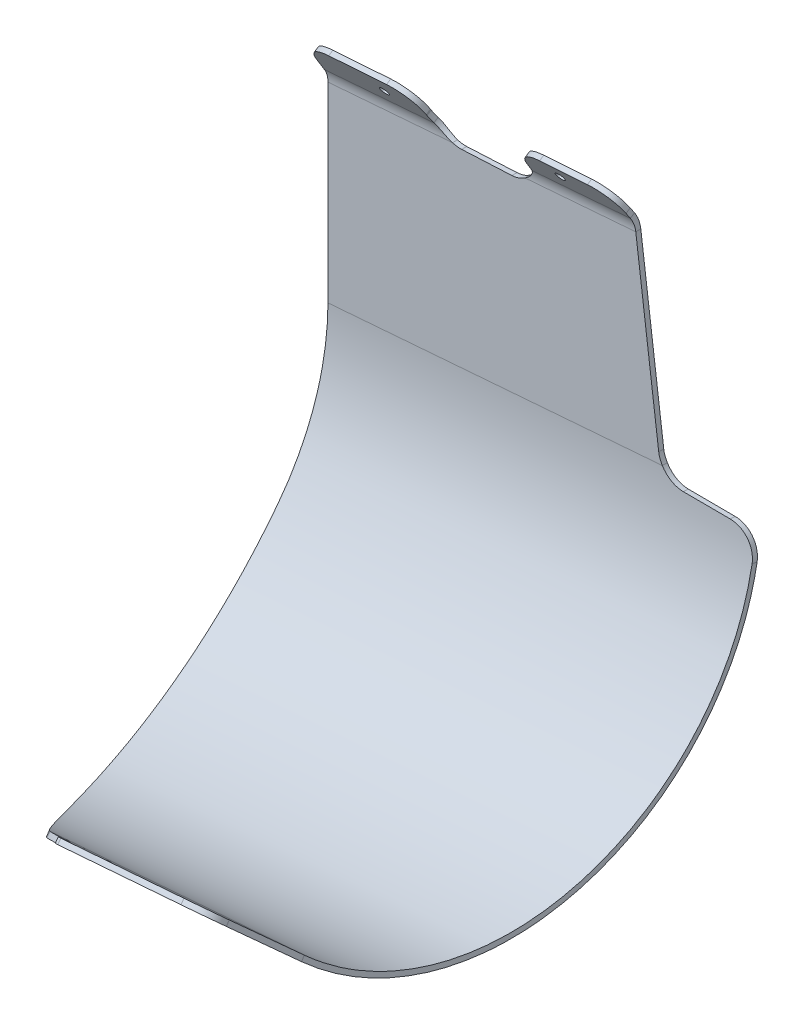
SolidWorks part; units mm, degrees
ref_plane "Face" through (0, 0, 0) normal (0, 0, 1) x (1, 0, 0)
ref_plane "Dessus" through (0, 0, 0) normal (0, 1, 0) x (1, 0, 0)
ref_plane "Droite" through (0, 0, 0) normal (1, 0, 0) x (0, 0, -1)
sketch "Esquisse1" plane through (0, 0, 0) normal (0, 0, 1) x (1, 0, 0)
  line L0 (73.5586, 64.3799) -> (36.1581, 64.3799)
  line L1 (93.5586, 44.3799) -> (93.5586, -455.6201)
  line L2 (73.5586, -475.6201) -> (-31.4414, -475.6201)
  line L3 (-36.4414, -470.6201) -> (-36.4414, -463.3378)
  line L4 (-246.4414, 228.3549) -> (-246.4414, -75.6201)
  line L5 (-24.9245, 258.4557) -> (-62.3527, 256.5843)
  line L6 (16.3205, 81.8366) -> (-4.0881, 241.024)
  line L7 (-161.2292, 231.6155) -> (-161.1793, 230.6167)
  line L8 (-140.2055, 211.6404) -> (-100.2554, 213.638)
  line L9 (-81.2791, 234.6118) -> (-81.329, 235.6105)
  line L10 (-182.203, 250.5918) -> (-227.4402, 248.3299)
  arc A0 (-246.4414, -75.6201) -> (-38.7097, -459.15) centre (211.4752, -75.6201) ccw
  circle A1 centre (-6.4414, -460.6201) radius 4.5
  circle A2 centre (-51.873, 246.0945) radius 3.5
  circle A3 centre (-191.4414, 235.1111) radius 3.5
  arc A4 (-36.4414, -463.3378) -> (-38.7097, -459.15) centre (-41.4414, -463.3378) ccw
  arc A5 (-31.4414, -475.6201) -> (-36.4414, -470.6201) centre (-31.4414, -470.6201) cw
  arc A6 (16.3205, 81.8366) -> (36.1581, 64.3799) centre (36.1581, 84.3799) ccw
  arc A7 (93.5586, 44.3799) -> (73.5586, 64.3799) centre (73.5586, 44.3799) ccw
  arc A8 (-4.0881, 241.024) -> (-24.9245, 258.4557) centre (-23.9258, 238.4807) ccw
  arc A9 (73.5586, -475.6201) -> (93.5586, -455.6201) centre (73.5586, -455.6201) ccw
  arc A10 (-227.4402, 248.3299) -> (-246.4414, 228.3549) centre (-226.4414, 228.3549) ccw
  arc A11 (-161.2292, 231.6155) -> (-182.203, 250.5918) centre (-181.2042, 230.6167) ccw
  arc A12 (-81.329, 235.6105) -> (-62.3527, 256.5843) centre (-61.354, 236.6093) cw
  arc A13 (-140.2055, 211.6404) -> (-161.1793, 230.6167) centre (-141.2042, 231.6155) cw
  arc A14 (-81.2791, 234.6118) -> (-100.2554, 213.638) centre (-101.2541, 233.613) cw
  point P1 (93.5586, 264.3799)
  point P15 (-36.4414, -460.6201)
  point P18 (-36.4414, -475.6201)
  point P24 (18.5586, 64.3799)
  point P27 (93.5586, 64.3799)
  point P30 (-6.4414, 259.3799)
  point P33 (93.5586, -475.6201)
  point P36 (-246.4414, 247.3799)
  point P43 (-162.2279, 251.5905)
  dimension "D6" = 7
  dimension "D7" = 9
  dimension "D11" = 457.9167
  dimension "D17" = 5
  dimension "D23" = 20
  dimension "D25" = 30
  dimension "D27" = 20
  dimension "D28" = 20
  dimension "D29" = 20
  dimension "D3" = 323
  dimension "D4" = 130
  dimension "D5" = 15
  dimension "D8" = 15
  dimension "D9" = 100
  dimension "D10" = 15
  dimension "D12" = 55
  dimension "D13" = 11
  dimension "D14" = 140
  dimension "D15" = 740
  dimension "D16" = 117.9167
  dimension "D18" = 340
  dimension "D19" = 17
  dimension "D20" = 100
  dimension "D21" = 75
  dimension "D22" = 200
  dimension "D24" = 80
  dimension "D26" = 41
extrude "Extrusion1" add sketch "Esquisse1" along normal blind 4
sheet metal parameters "Tôlerie 1" parameters "D1"=100
flatten bends "Dépliage 1" parameters "D1"=0
sketch "Esquisse-Angle1" plane through (0, 0, 4) normal (0, 0, 1) x (1, 0, 0)
process bends "Pliage 1" parameters "D1"=0
sketch "Esquisse-Plate1" plane through (0, 0, 4) normal (0, 0, 1) x (1, 0, 0)
  line L1 (93.5586, -455.6201) -> (93.5586, 44.3799) construction
  line L2 (-246.4414, 210.721) -> (-2.6627, 229.9053)
  line L6 (-246.4414, 228.3549) -> (-246.4414, -75.6201) construction
  line L7 (16.3205, 81.8366) -> (-4.0881, 241.024) construction
  line L8 (-234.4927, -179.5444) -> (93.5586, -153.7282)
  line L9 (-204.5131, 234.0824) -> (-34.248, 247.4816) construction
  arc A0 (-246.4414, -75.6201) -> (-38.7097, -459.15) centre (211.4752, -75.6201) ccw construction
  point P7 (-75.6303, -101.0261)
  dimension "D1" = 20
  dimension "D2" = 410
bend "Pli défini à plat1" bend radius 19 bend angle 32 parameters "D5"=1
bend "Pli défini à plat2" bend radius 200 bend angle 132 parameters "D5"=2
